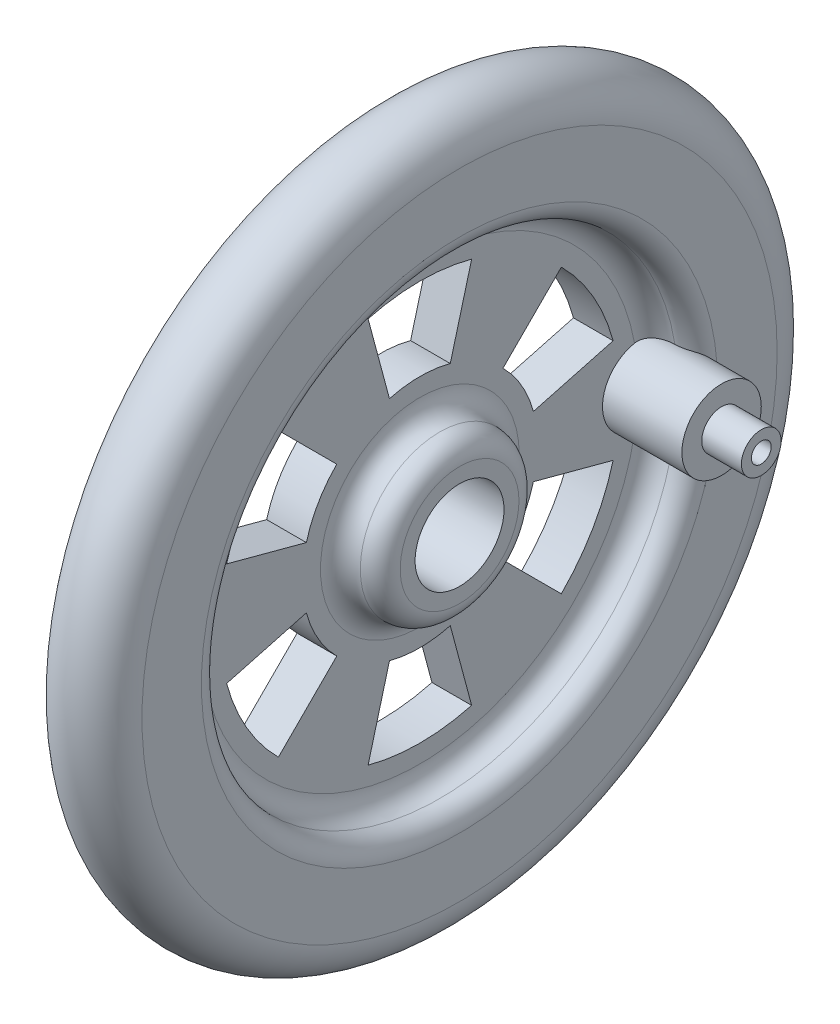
SolidWorks part; units mm, degrees
ref_plane "Plane1" through (0, 0, 0) normal (0, 0, 1) x (1, 0, 0)
ref_plane "Plane2" through (0, 0, 0) normal (0, 1, 0) x (1, 0, 0)
ref_plane "Plane3" through (0, 0, 0) normal (1, 0, 0) x (0, 0, -1)
sketch "Sketch1" plane through (0, 0, 0) normal (0, 0, 1) x (1, 0, 0)
  line L0 (0, 0) -> (-19.0395, 0) construction
  line L1 (0, 0) -> (6.35, 0)
  line L2 (0, 0) -> (0, 25.4)
  line L3 (0, 25.4) -> (6.35, 25.4) construction
  line L4 (6.35, 0) -> (6.35, 25.4)
  arc A0 (0, 25.4) -> (6.35, 25.4) centre (3.175, 25.4) cw
  dimension "D2" = 3.175
  dimension "D1" = 25.4
revolve "Revolve1" add sketch "Sketch1" angle 360 about L0
sketch "Sketch2" plane through (6.35, 0, 0) normal (1, 0, 0) x (0, 0, -1)
  circle A0 centre (0, 0) radius 19.05
  circle A1 centre (0, 0) radius 6.35
  dimension "D1" = 6.35
  dimension "D2" = 19.05
extrude "Cut-Extrude1" cut sketch "Sketch2" against normal up to vertex (3.175 mm away)
fillet "Fillet1" radius 1.6002 1 edges at (6.35, 0, -6.35)
fillet "Fillet2" radius 1.6002 2 edges at (3.175, 0, -6.35) (3.175, 0, -19.05)
fillet "Fillet3" radius 1.6002 1 edges at (6.35, 0, -19.05)
sketch "Sketch3" plane through (6.35, 0, 0) normal (1, 0, 0) x (0, 0, -1)
  circle A0 centre (0, 0) radius 3.556
  dimension "D1" = 7.112
extrude "Cut-Extrude2" cut sketch "Sketch3" against normal through all
sketch "Sketch4" plane through (3.175, 0, 0) normal (1, 0, 0) x (0, 0, -1)
  line L0 (6.6454, 6.6454) -> (11.3151, 11.3151)
  line L1 (9.0778, 2.4324) -> (15.4567, 4.1416)
  line L2 (0, 0) -> (30.779, 0) construction
  arc A0 (9.0778, 2.4324) -> (6.6454, 6.6454) centre (0, 0) ccw
  arc A1 (15.4567, 4.1416) -> (11.3151, 11.3151) centre (0, 0) ccw
  dimension "D3" = 9.398
  dimension "D4" = 16.002
  dimension "D1" = 15
  dimension "D2" = 30
extrude "Cut-Extrude3" cut sketch "Sketch4" against normal through all
pattern_circular "CirPattern1" count 6 over 360 about axis through (0, 0, 0) along (1, 0, 0) of "Cut-Extrude3"
sketch "Sketch5" plane through (3.175, 0, 0) normal (1, 0, 0) x (0, 0, -1)
  circle A0 centre (17.78, 0) radius 3.175
  circle A1 centre (0, 0) radius 3.556 construction
  dimension "D1" = 17.78
  dimension "D2" = 6.35
extrude "Boss-Extrude1" add sketch "Sketch5" along normal blind 6.35
sketch "Sketch6" plane through (9.525, 0, 0) normal (1, 0, 0) x (0, 0, -1)
  circle A0 centre (17.78, 0) radius 1.5875
  dimension "D1" = 3.175
extrude "Boss-Extrude2" add sketch "Sketch6" along normal blind 3.175
sketch "Sketch7" plane through (12.7, 0, 0) normal (1, 0, 0) x (0, 0, -1)
  circle A0 centre (17.78, 0) radius 0.7937
  dimension "D1" = 1.5875
extrude "Cut-Extrude4" cut sketch "Sketch7" against normal blind 6.35
